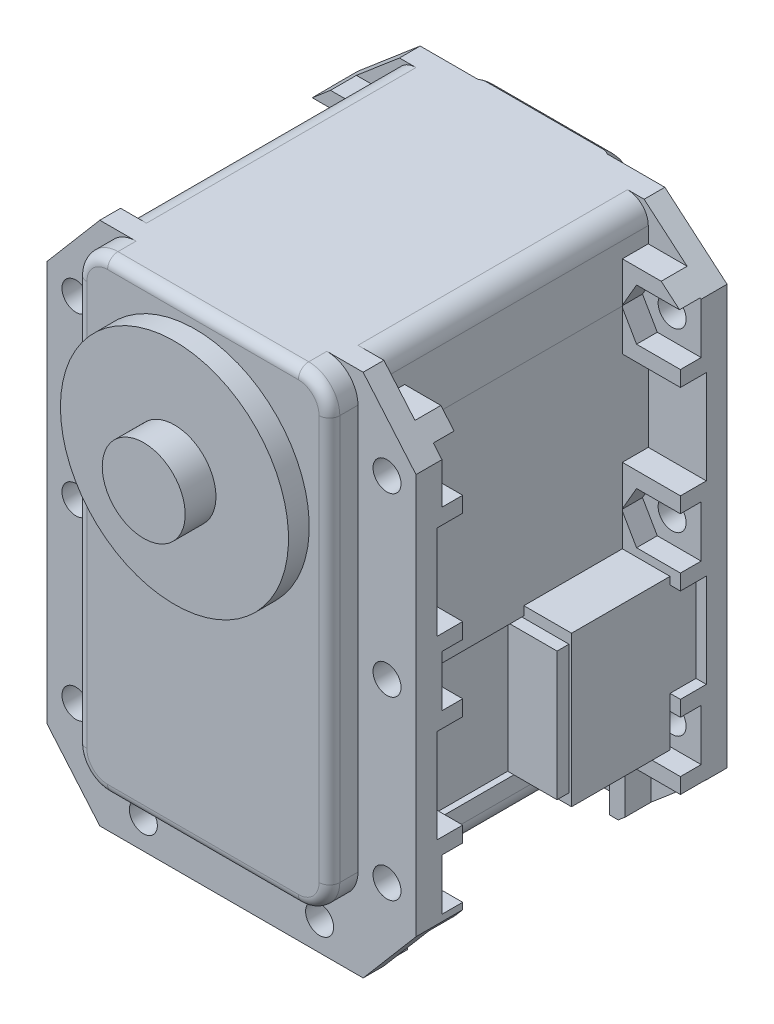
SolidWorks part; units mm, degrees
ref_plane "Front Plane" through (0, 0, 0) normal (0, 0, 1) x (1, 0, 0)
ref_plane "Top Plane" through (0, 0, 0) normal (0, 1, 0) x (1, 0, 0)
ref_plane "Right Plane" through (0, 0, 0) normal (1, 0, 0) x (0, 0, -1)
ref_plane "Plane1" through (7.15, 0, 0) normal (1, 0, 0) x (0, 0, -1)
sketch "Sketch1" plane through (7.15, 0, 0) normal (1, 0, 0) x (0, 0, -1)
  line L0 (15.2, 12) -> (15.2, 7)
  line L1 (15.2, 7) -> (17.75, 7)
  arc A0 (17.75, 7) -> (15.2, 12) centre (11.573, 7) ccw
extrude "Boss-Extrude1" add sketch "Sketch1" against normal blind 0.8723
sketch "Sketch2" plane through (6.2777, 0, 0) normal (-1, 0, 0) x (0, 0, 1)
  line L0 (-15.2, 7) -> (-17.75, 7)
  line L1 (-15.2, 12) -> (-15.2, 7)
  arc A0 (-17.75, 7) -> (-15.2, 12) centre (-11.573, 7) cw
extrude "Boss-Extrude2" add sketch "Sketch2" along normal blind 13.4277
ref_plane "Plane2" through (0, 7, 0) normal (0, -1, 0) x (1, 0, 0)
sketch "Sketch3" plane through (0, 7, 0) normal (0, -1, 0) x (1, 0, 0)
  line L0 (-17.8, -15.2) -> (-17.8, -17.75)
  line L1 (-17.8, -17.75) -> (-7.15, -17.75)
  line L2 (-7.15, -17.75) -> (-7.15, -15.2)
  line L3 (-7.15, -15.2) -> (-17.8, -15.2)
extrude "Boss-Extrude3" add sketch "Sketch3" against normal blind 5
sketch "Sketch4" plane through (0, 7, 0) normal (0, -1, 0) x (1, 0, 0)
  line L0 (7.15, -15.2) -> (7.15, -17.75)
  line L1 (7.15, -17.75) -> (17.8, -17.75)
  line L2 (17.8, -17.75) -> (17.8, -15.2)
  line L3 (17.8, -15.2) -> (7.15, -15.2)
extrude "Boss-Extrude4" add sketch "Sketch4" against normal blind 5
sketch "Sketch5" plane through (0, 7, 0) normal (0, -1, 0) x (1, 0, 0)
  line L0 (17.8, -15.2) -> (17.8, -17.75)
  line L1 (17.8, -17.75) -> (-17.8, -17.75)
  line L2 (-17.8, -17.75) -> (-17.8, -15.2)
  line L3 (-17.8, -15.2) -> (17.8, -15.2)
extrude "Boss-Extrude5" add sketch "Sketch5" along normal blind 40
sketch "Sketch6" plane through (0, 0, -15.2) normal (0, 0, 1) x (1, 0, 0)
  line L0 (17.8, -33) -> (-17.8, -33)
  line L1 (-17.8, -33) -> (-17.8, 12)
  line L2 (-17.8, 12) -> (17.8, 12)
  line L3 (17.8, 12) -> (17.8, -33)
extrude "Boss-Extrude6" add sketch "Sketch6" along normal blind 4.7
sketch "Sketch7" plane through (0, 0, -10.5) normal (0, 0, 1) x (1, 0, 0)
  line L0 (-8.5, -32.9421) -> (-8.6003, -33)
  line L1 (-8.6003, -33) -> (-17.8, -33)
  line L2 (-17.8, -33) -> (-17.8, 12)
  line L3 (-17.8, 12) -> (17.8, 12)
  line L4 (17.8, 12) -> (17.8, -33)
  line L5 (17.8, -33) -> (8.6003, -33)
  line L6 (8.6003, -33) -> (8.5, -32.9421)
  line L7 (8.5, -32.9421) -> (8.3997, -33)
  line L8 (8.3997, -33) -> (-8.3997, -33)
  line L9 (-8.3997, -33) -> (-8.5, -32.9421)
extrude "Boss-Extrude7" add sketch "Sketch7" along normal blind 21
sketch "Sketch8" plane through (0, 0, 10.5) normal (0, 0, 1) x (1, 0, 0)
  line L0 (-17.8, -33) -> (-17.8, 12)
  line L1 (-17.8, 12) -> (17.8, 12)
  line L2 (17.8, 12) -> (17.8, -33)
  line L3 (17.8, -33) -> (-17.8, -33)
extrude "Boss-Extrude8" add sketch "Sketch8" along normal blind 4.5
ref_plane "Plane3" through (0, 0, -1) normal (0, 0, -1) x (-1, 0, 0)
sketch "Sketch9" plane through (0, 0, -1) normal (0, 0, -1) x (-1, 0, 0)
  line L0 (12.2, -12.6003) -> (12.2, -33)
  line L1 (12.2, -33) -> (17.8, -33)
  line L2 (17.8, -33) -> (17.8, 12)
  line L3 (17.8, 12) -> (12.2, 12)
  line L4 (12.2, 12) -> (12.2, 4.6003)
  line L5 (12.2, 4.6003) -> (12.1421, 4.5)
  line L6 (12.1421, 4.5) -> (12.2, 4.3997)
  line L7 (12.2, 4.3997) -> (12.2, -12.3997)
  line L8 (12.2, -12.3997) -> (12.1421, -12.5)
  line L9 (12.1421, -12.5) -> (12.2, -12.6003)
extrude "Cut-Extrude1" cut sketch "Sketch9" against normal blind 11.5
sketch "Sketch10" plane through (0, 0, -17.75) normal (0, 0, -1) x (-1, 0, 0)
  line L0 (-16.8, -33) -> (-16.8, 12)
  line L1 (-16.8, 12) -> (-17.8, 12)
  line L2 (-17.8, 12) -> (-17.8, -33)
  line L3 (-17.8, -33) -> (-16.8, -33)
extrude "Cut-Extrude2" cut sketch "Sketch10" against normal blind 16.75
sketch "Sketch11" plane through (0, 0, -1) normal (0, 0, -1) x (-1, 0, 0)
  line L0 (-17.8, -33) -> (-12.2, -33)
  line L1 (-12.2, -33) -> (-12.2, -12.6003)
  line L2 (-12.2, -12.6003) -> (-12.1421, -12.5)
  line L3 (-12.1421, -12.5) -> (-12.2, -12.3997)
  line L4 (-12.2, -12.3997) -> (-12.2, 4.3997)
  line L5 (-12.2, 4.3997) -> (-12.1421, 4.5)
  line L6 (-12.1421, 4.5) -> (-12.2, 4.6003)
  line L7 (-12.2, 4.6003) -> (-12.2, 12)
  line L8 (-12.2, 12) -> (-17.8, 12)
  line L9 (-17.8, 12) -> (-17.8, -33)
extrude "Cut-Extrude3" cut sketch "Sketch11" against normal blind 11.5
sketch "Sketch12" plane through (0, -33, 0) normal (0, -1, 0) x (1, 0, 0)
  line L0 (12.2, -1) -> (12.2, -10.5)
  line L1 (12.2, -10.5) -> (16.8, -10.5)
  line L2 (16.8, -10.5) -> (16.8, -1)
  line L3 (16.8, -1) -> (12.2, -1)
extrude "Cut-Extrude4" cut sketch "Sketch12" against normal blind 2.75
sketch "Sketch13" plane through (0, 0, -1) normal (0, 0, 1) x (1, 0, 0)
  line L0 (-12.2, -33) -> (-12.2, -30.25)
  line L1 (-12.2, -30.25) -> (-16.8, -30.25)
  line L2 (-16.8, -30.25) -> (-16.8, -27.025)
  line L3 (-16.8, -27.025) -> (-17.8, -27.025)
  line L4 (-17.8, -27.025) -> (-17.8, -33)
  line L5 (-17.8, -33) -> (-12.2, -33)
extrude "Cut-Extrude5" cut sketch "Sketch13" against normal blind 9.5
sketch "Sketch14" plane through (0, 0, -10.5) normal (0, 0, 1) x (1, 0, 0)
  line L0 (-17.8, -27.025) -> (-17.8, -31.975)
  line L1 (-17.8, -31.975) -> (-13.5711, -31.975)
  line L2 (-13.5711, -31.975) -> (-12.1421, -29.5)
  line L3 (-12.1421, -29.5) -> (-13.5711, -27.025)
  line L4 (-13.5711, -27.025) -> (-17.8, -27.025)
extrude "Cut-Extrude6" cut sketch "Sketch14" against normal blind 2
sketch "Sketch15" plane through (0, 0, -10.5) normal (0, 0, 1) x (1, 0, 0)
  line L0 (13.5711, -31.975) -> (16.8, -31.975)
  line L1 (16.8, -31.975) -> (16.8, -27.025)
  line L2 (16.8, -27.025) -> (13.5711, -27.025)
  line L3 (13.5711, -27.025) -> (12.1421, -29.5)
  line L4 (12.1421, -29.5) -> (13.5711, -31.975)
extrude "Cut-Extrude7" cut sketch "Sketch15" against normal blind 2
sketch "Sketch16" plane through (0, 0, 10.5) normal (0, 0, -1) x (-1, 0, 0)
  line L0 (12.1421, -29.5) -> (13.5711, -31.975)
  line L1 (13.5711, -31.975) -> (17.8, -31.975)
  line L2 (17.8, -31.975) -> (17.8, -27.025)
  line L3 (17.8, -27.025) -> (13.5711, -27.025)
  line L4 (13.5711, -27.025) -> (12.1421, -29.5)
extrude "Cut-Extrude8" cut sketch "Sketch16" against normal blind 2
sketch "Sketch17" plane through (0, 0, 10.5) normal (0, 0, -1) x (-1, 0, 0)
  line L0 (-12.1421, -29.5) -> (-13.5711, -27.025)
  line L1 (-13.5711, -27.025) -> (-17.8, -27.025)
  line L2 (-17.8, -27.025) -> (-17.8, -31.975)
  line L3 (-17.8, -31.975) -> (-13.5711, -31.975)
  line L4 (-13.5711, -31.975) -> (-12.1421, -29.5)
extrude "Cut-Extrude9" cut sketch "Sketch17" against normal blind 2
sketch "Sketch18" plane through (0, 0, -1) normal (0, 0, 1) x (1, 0, 0)
  line L0 (-12.1421, 4.5) -> (-12.2, 4.6003)
  line L1 (-12.2, 4.6003) -> (-12.2, 12)
  line L2 (-12.2, 12) -> (-17.8, 12)
  line L3 (-17.8, 12) -> (-17.8, -27.025)
  line L4 (-17.8, -27.025) -> (-16.8, -27.025)
  line L5 (-16.8, -27.025) -> (-16.8, -14.975)
  line L6 (-16.8, -14.975) -> (-13.5711, -14.975)
  line L7 (-13.5711, -14.975) -> (-12.1421, -12.5)
  line L8 (-12.1421, -12.5) -> (-12.2, -12.3997)
  line L9 (-12.2, -12.3997) -> (-12.2, 4.3997)
  line L10 (-12.2, 4.3997) -> (-12.1421, 4.5)
extrude "Cut-Extrude10" cut sketch "Sketch18" against normal blind 9.5
sketch "Sketch19" plane through (0, 0, -1) normal (0, 0, 1) x (1, 0, 0)
  line L0 (16.8, -14.975) -> (16.8, 12)
  line L1 (16.8, 12) -> (12.2, 12)
  line L2 (12.2, 12) -> (12.2, 4.6003)
  line L3 (12.2, 4.6003) -> (12.1421, 4.5)
  line L4 (12.1421, 4.5) -> (12.2, 4.3997)
  line L5 (12.2, 4.3997) -> (12.2, -12.3997)
  line L6 (12.2, -12.3997) -> (12.1421, -12.5)
  line L7 (12.1421, -12.5) -> (13.5711, -14.975)
  line L8 (13.5711, -14.975) -> (16.8, -14.975)
extrude "Cut-Extrude11" cut sketch "Sketch19" against normal blind 9.5
sketch "Sketch20" plane through (0, -33, 0) normal (0, -1, 0) x (1, 0, 0)
  line L0 (-17.8, -17.75) -> (-17.8, -10.5)
  line L1 (-17.8, -10.5) -> (16.8, -10.5)
  line L2 (16.8, -10.5) -> (16.8, -17.75)
  line L3 (16.8, -17.75) -> (-17.8, -17.75)
extrude "Boss-Extrude9" add sketch "Sketch20" along normal blind 5.6
sketch "Sketch21" plane through (0, 0, -17.75) normal (0, 0, -1) x (-1, 0, 0)
  line L0 (-7.15, 12) -> (-16.8, 12)
  line L1 (-16.8, 12) -> (-16.8, -38.6)
  line L2 (-16.8, -38.6) -> (17.8, -38.6)
  line L3 (17.8, -38.6) -> (17.8, 12)
  line L4 (17.8, 12) -> (7.15, 12)
  line L5 (7.15, 12) -> (7.15, 7)
  line L6 (7.15, 7) -> (12.2, 7)
  line L7 (12.2, 7) -> (12.2, -28)
  line L8 (12.2, -28) -> (-12.2, -28)
  line L9 (-12.2, -28) -> (-12.2, 7)
  line L10 (-12.2, 7) -> (-7.15, 7)
  line L11 (-7.15, 7) -> (-7.15, 12)
extrude "Cut-Extrude12" cut sketch "Sketch21" against normal blind 2.55
sketch "Sketch22" plane through (0, 0, -15.2) normal (0, 0, -1) x (-1, 0, 0)
  line L0 (-7.15, 12) -> (-16.8, 12)
  line L1 (-16.8, 12) -> (-16.8, -38.6)
  line L2 (-16.8, -38.6) -> (17.8, -38.6)
  line L3 (17.8, -38.6) -> (17.8, 12)
  line L4 (17.8, 12) -> (7.15, 12)
  line L5 (7.15, 12) -> (7.15, 7)
  line L6 (7.15, 7) -> (12.2, 7)
  line L7 (12.2, 7) -> (12.2, -28)
  line L8 (12.2, -28) -> (-12.2, -28)
  line L9 (-12.2, -28) -> (-12.2, 7)
  line L10 (-12.2, 7) -> (-7.15, 7)
  line L11 (-7.15, 7) -> (-7.15, 12)
extrude "Cut-Extrude13" cut sketch "Sketch22" against normal blind 0.2
sketch "Sketch23" plane through (16.8, 0, 0) normal (1, 0, 0) x (0, 0, -1)
  line L0 (10.5, 12) -> (15, 12)
  line L1 (15, 12) -> (15, -38.6)
  line L2 (15, -38.6) -> (10.5, -38.6)
  line L3 (10.5, -38.6) -> (10.5, -31.975)
  line L4 (10.5, -31.975) -> (12.5, -31.975)
  line L5 (12.5, -31.975) -> (12.5, -27.025)
  line L6 (12.5, -27.025) -> (10.5, -27.025)
  line L7 (10.5, -27.025) -> (10.5, 12)
extrude "Boss-Extrude10" add sketch "Sketch23" along normal blind 1
sketch "Sketch24" plane through (0, -33, 0) normal (0, -1, 0) x (1, 0, 0)
  line L0 (-17.8, 10.5) -> (-17.8, 15)
  line L1 (-17.8, 15) -> (17.8, 15)
  line L2 (17.8, 15) -> (17.8, 10.5)
  line L3 (17.8, 10.5) -> (-17.8, 10.5)
extrude "Boss-Extrude11" add sketch "Sketch24" along normal blind 5.6
sketch "Sketch25" plane through (-12.2, 0, 0) normal (-1, 0, 0) x (0, 0, 1)
  line L0 (-1, -29.4) -> (10.5, -29.4)
  line L1 (10.5, -29.4) -> (10.5, -16.6)
  line L2 (10.5, -16.6) -> (-1, -16.6)
  line L3 (-1, -16.6) -> (-1, -29.4)
extrude "Cut-Extrude14" cut sketch "Sketch25" against normal blind 0.6
sketch "Sketch26" plane through (12.2, 0, 0) normal (1, 0, 0) x (0, 0, -1)
  line L0 (1, -16.6) -> (-10.5, -16.6)
  line L1 (-10.5, -16.6) -> (-10.5, -29.4)
  line L2 (-10.5, -29.4) -> (1, -29.4)
  line L3 (1, -29.4) -> (1, -16.6)
extrude "Cut-Extrude15" cut sketch "Sketch26" against normal blind 0.6
sketch "Sketch27" plane through (0, 0, -10.5) normal (0, 0, 1) x (1, 0, 0)
  line L0 (-17.8, 6.975) -> (-17.8, 2.025)
  line L1 (-17.8, 2.025) -> (-13.5711, 2.025)
  line L2 (-13.5711, 2.025) -> (-12.1421, 4.5)
  line L3 (-12.1421, 4.5) -> (-13.5711, 6.975)
  line L4 (-13.5711, 6.975) -> (-17.8, 6.975)
extrude "Cut-Extrude16" cut sketch "Sketch27" against normal blind 2
sketch "Sketch28" plane through (0, 0, -10.5) normal (0, 0, 1) x (1, 0, 0)
  line L0 (-17.8, -14.975) -> (-13.5711, -14.975)
  line L1 (-13.5711, -14.975) -> (-12.1421, -12.5)
  line L2 (-12.1421, -12.5) -> (-13.5711, -10.025)
  line L3 (-13.5711, -10.025) -> (-17.8, -10.025)
  line L4 (-17.8, -10.025) -> (-17.8, -14.975)
extrude "Cut-Extrude17" cut sketch "Sketch28" against normal blind 2
sketch "Sketch29" plane through (0, 0, -10.5) normal (0, 0, 1) x (1, 0, 0)
  line L0 (-6.025, -38.6) -> (-6.025, -34.3711)
  line L1 (-6.025, -34.3711) -> (-8.5, -32.9421)
  line L2 (-8.5, -32.9421) -> (-10.975, -34.3711)
  line L3 (-10.975, -34.3711) -> (-10.975, -38.6)
  line L4 (-10.975, -38.6) -> (-6.025, -38.6)
extrude "Cut-Extrude18" cut sketch "Sketch29" against normal blind 2
sketch "Sketch30" plane through (0, 0, -10.5) normal (0, 0, 1) x (1, 0, 0)
  line L0 (17.8, 2.025) -> (17.8, 6.975)
  line L1 (17.8, 6.975) -> (13.5711, 6.975)
  line L2 (13.5711, 6.975) -> (12.1421, 4.5)
  line L3 (12.1421, 4.5) -> (13.5711, 2.025)
  line L4 (13.5711, 2.025) -> (17.8, 2.025)
extrude "Cut-Extrude19" cut sketch "Sketch30" against normal blind 2
sketch "Sketch31" plane through (0, 0, -10.5) normal (0, 0, 1) x (1, 0, 0)
  line L0 (17.8, -10.025) -> (13.5711, -10.025)
  line L1 (13.5711, -10.025) -> (12.1421, -12.5)
  line L2 (12.1421, -12.5) -> (13.5711, -14.975)
  line L3 (13.5711, -14.975) -> (17.8, -14.975)
  line L4 (17.8, -14.975) -> (17.8, -10.025)
extrude "Cut-Extrude20" cut sketch "Sketch31" against normal blind 2
sketch "Sketch32" plane through (0, 0, -10.5) normal (0, 0, 1) x (1, 0, 0)
  line L0 (10.975, -38.6) -> (10.975, -34.3711)
  line L1 (10.975, -34.3711) -> (8.5, -32.9421)
  line L2 (8.5, -32.9421) -> (6.025, -34.3711)
  line L3 (6.025, -34.3711) -> (6.025, -38.6)
  line L4 (6.025, -38.6) -> (10.975, -38.6)
extrude "Cut-Extrude21" cut sketch "Sketch32" against normal blind 2
sketch "Sketch33" plane through (0, 0, 10.5) normal (0, 0, -1) x (-1, 0, 0)
  line L0 (13.5711, 2.025) -> (17.8, 2.025)
  line L1 (17.8, 2.025) -> (17.8, 6.975)
  line L2 (17.8, 6.975) -> (13.5711, 6.975)
  line L3 (13.5711, 6.975) -> (12.1421, 4.5)
  line L4 (12.1421, 4.5) -> (13.5711, 2.025)
extrude "Cut-Extrude22" cut sketch "Sketch33" against normal blind 2
sketch "Sketch34" plane through (0, 0, 10.5) normal (0, 0, -1) x (-1, 0, 0)
  line L0 (12.1421, -12.5) -> (13.5711, -14.975)
  line L1 (13.5711, -14.975) -> (17.8, -14.975)
  line L2 (17.8, -14.975) -> (17.8, -10.025)
  line L3 (17.8, -10.025) -> (13.5711, -10.025)
  line L4 (13.5711, -10.025) -> (12.1421, -12.5)
extrude "Cut-Extrude23" cut sketch "Sketch34" against normal blind 2
sketch "Sketch35" plane through (0, 0, 10.5) normal (0, 0, -1) x (-1, 0, 0)
  line L0 (8.5, -32.9421) -> (6.025, -34.3711)
  line L1 (6.025, -34.3711) -> (6.025, -38.6)
  line L2 (6.025, -38.6) -> (10.975, -38.6)
  line L3 (10.975, -38.6) -> (10.975, -34.3711)
  line L4 (10.975, -34.3711) -> (8.5, -32.9421)
extrude "Cut-Extrude24" cut sketch "Sketch35" against normal blind 2
sketch "Sketch36" plane through (0, 0, 10.5) normal (0, 0, -1) x (-1, 0, 0)
  line L0 (-12.1421, 4.5) -> (-13.5711, 6.975)
  line L1 (-13.5711, 6.975) -> (-17.8, 6.975)
  line L2 (-17.8, 6.975) -> (-17.8, 2.025)
  line L3 (-17.8, 2.025) -> (-13.5711, 2.025)
  line L4 (-13.5711, 2.025) -> (-12.1421, 4.5)
extrude "Cut-Extrude25" cut sketch "Sketch36" against normal blind 2
sketch "Sketch37" plane through (0, 0, 10.5) normal (0, 0, -1) x (-1, 0, 0)
  line L0 (-12.1421, -12.5) -> (-13.5711, -10.025)
  line L1 (-13.5711, -10.025) -> (-17.8, -10.025)
  line L2 (-17.8, -10.025) -> (-17.8, -14.975)
  line L3 (-17.8, -14.975) -> (-13.5711, -14.975)
  line L4 (-13.5711, -14.975) -> (-12.1421, -12.5)
extrude "Cut-Extrude26" cut sketch "Sketch37" against normal blind 2
sketch "Sketch38" plane through (0, 0, 10.5) normal (0, 0, -1) x (-1, 0, 0)
  line L0 (-8.5, -32.9421) -> (-10.975, -34.3711)
  line L1 (-10.975, -34.3711) -> (-10.975, -38.6)
  line L2 (-10.975, -38.6) -> (-6.025, -38.6)
  line L3 (-6.025, -38.6) -> (-6.025, -34.3711)
  line L4 (-6.025, -34.3711) -> (-8.5, -32.9421)
extrude "Cut-Extrude27" cut sketch "Sketch38" against normal blind 2
ref_plane "Plane4" through (0, 0, -10.5) normal (0, 0, -1) x (-1, 0, 0)
sketch "Sketch39" plane through (0, 0, -10.5) normal (0, 0, -1) x (-1, 0, 0)
  line L0 (12.2, -14.975) -> (13.5711, -14.975)
  line L1 (13.5711, -14.975) -> (12.2, -12.6003)
  line L2 (12.2, -12.6003) -> (12.2, -14.975)
extrude "Cut-Extrude28" cut sketch "Sketch39" against normal up to next
sketch "Sketch40" plane through (0, -14.975, 0) normal (0, 1, 0) x (-1, 0, 0)
  line L0 (16.8, -10.5) -> (16.8, -1)
  line L1 (16.8, -1) -> (12.2, -1)
  line L2 (12.2, -1) -> (12.2, -10.5)
  line L3 (12.2, -10.5) -> (16.8, -10.5)
extrude "Cut-Extrude29" cut sketch "Sketch40" against normal blind 0.775
sketch "Sketch41" plane through (0, 0, -10.5) normal (0, 0, -1) x (-1, 0, 0)
  line L0 (-13.5711, -14.975) -> (-12.2, -14.975)
  line L1 (-12.2, -14.975) -> (-12.2, -12.6003)
  line L2 (-12.2, -12.6003) -> (-13.5711, -14.975)
extrude "Cut-Extrude30" cut sketch "Sketch41" against normal up to next
sketch "Sketch42" plane through (0, -14.975, 0) normal (0, 1, 0) x (-1, 0, 0)
  line L0 (-16.8, -1) -> (-16.8, -10.5)
  line L1 (-16.8, -10.5) -> (-12.2, -10.5)
  line L2 (-12.2, -10.5) -> (-12.2, -1)
  line L3 (-12.2, -1) -> (-16.8, -1)
extrude "Cut-Extrude31" cut sketch "Sketch42" against normal blind 0.775
sketch "Sketch43" plane through (0, -38.6, 0) normal (0, -1, 0) x (1, 0, 0)
  line L0 (-4.525, 13) -> (-4.525, 10.5)
  line L1 (-4.525, 10.5) -> (4.525, 10.5)
  line L2 (4.525, 10.5) -> (4.525, 13)
  line L3 (4.525, 13) -> (-4.525, 13)
extrude "Cut-Extrude32" cut sketch "Sketch43" against normal blind 5.6
sketch "Sketch44" plane through (0, 0, 10.5) normal (0, 0, -1) x (-1, 0, 0)
  line L0 (-17.8, -16.475) -> (-17.8, -25.525)
  line L1 (-17.8, -25.525) -> (-12.2, -25.525)
  line L2 (-12.2, -25.525) -> (-12.2, -16.475)
  line L3 (-12.2, -16.475) -> (-17.8, -16.475)
extrude "Cut-Extrude33" cut sketch "Sketch44" against normal blind 2.5
sketch "Sketch45" plane through (0, -38.6, 0) normal (0, -1, 0) x (1, 0, 0)
  line L0 (-4.525, -10.5) -> (-4.525, -13)
  line L1 (-4.525, -13) -> (4.525, -13)
  line L2 (4.525, -13) -> (4.525, -10.5)
  line L3 (4.525, -10.5) -> (-4.525, -10.5)
extrude "Cut-Extrude34" cut sketch "Sketch45" against normal blind 5.6
sketch "Sketch46" plane through (-17.8, 0, 0) normal (-1, 0, 0) x (0, 0, 1)
  line L0 (-10.5, 0.525) -> (-13, 0.525)
  line L1 (-13, 0.525) -> (-13, -8.525)
  line L2 (-13, -8.525) -> (-10.5, -8.525)
  line L3 (-10.5, -8.525) -> (-10.5, 0.525)
extrude "Cut-Extrude35" cut sketch "Sketch46" against normal blind 5.6
sketch "Sketch47" plane through (17.8, 0, 0) normal (1, 0, 0) x (0, 0, -1)
  line L0 (10.5, -25.525) -> (13, -25.525)
  line L1 (13, -25.525) -> (13, -16.475)
  line L2 (13, -16.475) -> (10.5, -16.475)
  line L3 (10.5, -16.475) -> (10.5, -25.525)
extrude "Cut-Extrude36" cut sketch "Sketch47" against normal blind 1
sketch "Sketch48" plane through (-17.8, 0, 0) normal (-1, 0, 0) x (0, 0, 1)
  line L0 (13, -16.475) -> (10.5, -16.475)
  line L1 (10.5, -16.475) -> (10.5, -25.525)
  line L2 (10.5, -25.525) -> (13, -25.525)
  line L3 (13, -25.525) -> (13, -16.475)
extrude "Cut-Extrude37" cut sketch "Sketch48" against normal blind 5.6
sketch "Sketch49" plane through (-17.8, 0, 0) normal (-1, 0, 0) x (0, 0, 1)
  line L0 (-10.5, -16.475) -> (-13, -16.475)
  line L1 (-13, -16.475) -> (-13, -25.525)
  line L2 (-13, -25.525) -> (-10.5, -25.525)
  line L3 (-10.5, -25.525) -> (-10.5, -16.475)
extrude "Cut-Extrude38" cut sketch "Sketch49" against normal blind 1
sketch "Sketch50" plane through (17.8, 0, 0) normal (1, 0, 0) x (0, 0, -1)
  line L0 (-13, 8.475) -> (-10.5, 8.475)
  line L1 (-10.5, 8.475) -> (-10.5, 12)
  line L2 (-10.5, 12) -> (-13, 12)
  line L3 (-13, 12) -> (-13, 8.475)
extrude "Cut-Extrude39" cut sketch "Sketch50" against normal blind 5.6
sketch "Sketch51" plane through (-17.8, 0, 0) normal (-1, 0, 0) x (0, 0, 1)
  line L0 (13, 0.525) -> (10.5, 0.525)
  line L1 (10.5, 0.525) -> (10.5, -8.525)
  line L2 (10.5, -8.525) -> (13, -8.525)
  line L3 (13, -8.525) -> (13, 0.525)
extrude "Cut-Extrude40" cut sketch "Sketch51" against normal blind 5.6
sketch "Sketch52" plane through (17.8, 0, 0) normal (1, 0, 0) x (0, 0, -1)
  line L0 (10.5, -8.525) -> (13, -8.525)
  line L1 (13, -8.525) -> (13, 0.525)
  line L2 (13, 0.525) -> (10.5, 0.525)
  line L3 (10.5, 0.525) -> (10.5, -8.525)
extrude "Cut-Extrude41" cut sketch "Sketch52" against normal blind 5.6
sketch "Sketch53" plane through (17.8, 0, 0) normal (1, 0, 0) x (0, 0, -1)
  line L0 (-13, -8.525) -> (-10.5, -8.525)
  line L1 (-10.5, -8.525) -> (-10.5, 0.525)
  line L2 (-10.5, 0.525) -> (-13, 0.525)
  line L3 (-13, 0.525) -> (-13, -8.525)
extrude "Cut-Extrude42" cut sketch "Sketch53" against normal blind 5.6
sketch "Sketch54" plane through (17.8, 0, 0) normal (1, 0, 0) x (0, 0, -1)
  line L0 (10.5, 8.475) -> (13, 8.475)
  line L1 (13, 8.475) -> (13, 12)
  line L2 (13, 12) -> (10.5, 12)
  line L3 (10.5, 12) -> (10.5, 8.475)
extrude "Cut-Extrude43" cut sketch "Sketch54" against normal blind 5.6
sketch "Sketch55" plane through (-17.8, 0, 0) normal (-1, 0, 0) x (0, 0, 1)
  line L0 (10.5, 8.475) -> (13, 8.475)
  line L1 (13, 8.475) -> (13, 12)
  line L2 (13, 12) -> (10.5, 12)
  line L3 (10.5, 12) -> (10.5, 8.475)
extrude "Cut-Extrude44" cut sketch "Sketch55" against normal blind 5.6
sketch "Sketch56" plane through (-17.8, 0, 0) normal (-1, 0, 0) x (0, 0, 1)
  line L0 (-13, 8.475) -> (-10.5, 8.475)
  line L1 (-10.5, 8.475) -> (-10.5, 12)
  line L2 (-10.5, 12) -> (-13, 12)
  line L3 (-13, 12) -> (-13, 8.475)
extrude "Cut-Extrude45" cut sketch "Sketch56" against normal blind 5.6
sketch "Sketch57" plane through (0, 0, -15) normal (0, 0, -1) x (-1, 0, 0)
  line L0 (-7.15, -33) -> (-7.15, -28)
  line L1 (-7.15, -28) -> (7.15, -28)
  line L2 (7.15, -28) -> (7.15, -33)
  line L3 (7.15, -33) -> (-7.15, -33)
extrude "Boss-Extrude12" add sketch "Sketch57" along normal blind 2.75
sketch "Sketch58" plane through (-17.8, 0, 0) normal (-1, 0, 0) x (0, 0, 1)
  line L0 (-10.5, -33.475) -> (-13, -33.475)
  line L1 (-13, -33.475) -> (-13, -38.6)
  line L2 (-13, -38.6) -> (-10.5, -38.6)
  line L3 (-10.5, -38.6) -> (-10.5, -33.475)
extrude "Cut-Extrude46" cut sketch "Sketch58" against normal blind 5.325
sketch "Sketch59" plane through (0, 0, -10.5) normal (0, 0, 1) x (1, 0, 0)
  line L0 (17.8, -33.475) -> (12.475, -33.475)
  line L1 (12.475, -33.475) -> (12.475, -38.6)
  line L2 (12.475, -38.6) -> (17.8, -38.6)
  line L3 (17.8, -38.6) -> (17.8, -33.475)
extrude "Cut-Extrude47" cut sketch "Sketch59" against normal blind 2.5
sketch "Sketch60" plane through (-17.8, 0, 0) normal (-1, 0, 0) x (0, 0, 1)
  line L0 (10.5, -38.6) -> (13, -38.6)
  line L1 (13, -38.6) -> (13, -33.475)
  line L2 (13, -33.475) -> (10.5, -33.475)
  line L3 (10.5, -33.475) -> (10.5, -38.6)
extrude "Cut-Extrude48" cut sketch "Sketch60" against normal blind 5.325
sketch "Sketch61" plane through (0, -38.6, 0) normal (0, -1, 0) x (1, 0, 0)
  line L0 (12.475, 13) -> (12.475, 10.5)
  line L1 (12.475, 10.5) -> (17.8, 10.5)
  line L2 (17.8, 10.5) -> (17.8, 13)
  line L3 (17.8, 13) -> (12.475, 13)
extrude "Cut-Extrude49" cut sketch "Sketch61" against normal blind 5.125
sketch "Sketch62" plane through (0, 0, 15) normal (0, 0, 1) x (1, 0, 0)
  line L0 (-12.2, -33) -> (-12.2, 12)
  line L1 (-12.2, 12) -> (12.2, 12)
  line L2 (12.2, 12) -> (12.2, -33)
  line L3 (12.2, -33) -> (-12.2, -33)
extrude "Boss-Extrude13" add sketch "Sketch62" along normal blind 2.75
sketch "Sketch63" plane through (0, 0, -1) normal (0, 0, 1) x (1, 0, 0)
  line L0 (-16.55, -29.21) -> (-16.55, -16.79)
  line L1 (-16.55, -16.79) -> (-11.83, -16.79)
  line L2 (-11.83, -16.79) -> (-11.83, -29.21)
  line L3 (-11.83, -29.21) -> (-16.55, -29.21)
extrude "Boss-Extrude14" add sketch "Sketch63" along normal blind 1.15
sketch "Sketch64" plane through (0, 0, -1) normal (0, 0, 1) x (1, 0, 0)
  line L0 (16.55, -29.21) -> (11.83, -29.21)
  line L1 (11.83, -29.21) -> (11.83, -16.79)
  line L2 (11.83, -16.79) -> (16.55, -16.79)
  line L3 (16.55, -16.79) -> (16.55, -29.21)
extrude "Boss-Extrude15" add sketch "Sketch64" along normal blind 1.15
hole_wizard "Ø13.0 (13) Diameter Hole1" positions "Sketch66" profile "Sketch65" hole size "Ø13.0" standard "ANSI Metric"
sketch "Sketch66" plane through (0, 0, -17.75) normal (0, 0, -1) x (-1, 0, 0)
  point P0 (0, 0)
sketch "Sketch65" plane through (0, 0, -17.75) normal (1, 0, 0) x (0, 1, 0)
  line L0 (0, 0) -> (0, 1)
  line L1 (0, 1) -> (6.5, 1)
  line L2 (6.5, 1) -> (6.5, 0)
  line L5 (6.5, 0) -> (0, 0)
  line L10 (0, 1) -> (-6.5, 1) construction
  line L11 (0, -6.35) -> (0, 107.95) construction
  dimension "Hole Dia." = 13
  dimension "Hole Depth" = 1
  dimension "Drill Angle" = 180
ref_plane "Plane5" through (0, 0, 0) normal (0, -1, 0) x (1, 0, 0)
sketch "Sketch67" plane through (0, 0, 0) normal (0, -1, 0) x (1, 0, 0)
  line L1 (0, 23.4656) -> (0, 17.75)
  line L2 (0, 17.75) -> (5, 17.75)
  line L3 (5, 17.75) -> (5, 18.5)
  line L4 (5, 18.5) -> (11, 18.5)
  line L5 (11, 18.5) -> (11, 20.5)
  line L6 (11, 20.5) -> (4, 20.5)
  line L7 (4, 20.5) -> (4, 23.4656)
  line L8 (4, 23.4656) -> (0, 23.4656)
  line L10 (0, 25.85) -> (0, 17.75) construction
  dimension "D1" = 11
  dimension "D2" = 2
  dimension "D3" = 2.9656
  dimension "D4" = 4
revolve "Revolve1" add sketch "Sketch67" angle 360 about L10
hole_wizard "Ø2.7 (2.7) Diameter Hole1" positions "Sketch70" profile "Sketch69" hole size "Ø2.7" standard "ANSI Metric"
sketch "Sketch70" plane through (0, 0, 12.5) normal (0, 0, -1) x (-1, 0, 0)
  point P0 (15, 4.5)
  point P1 (15, -12.5)
  point P2 (8.5, -35.8)
  point P3 (-15, 4.5)
  point P4 (-15, -12.5)
  point P5 (-8.5, -35.8)
  point P6 (15, -29.5)
  point P7 (-15, -29.5)
sketch "Sketch69" plane through (-15, 4.5, 12.5) normal (1, 0, 0) x (0, 1, 0)
  line L0 (0, 0) -> (0, 10.9656)
  line L1 (0, 10.9656) -> (1.35, 10.9656)
  line L2 (1.35, 10.9656) -> (1.35, 0)
  line L5 (1.35, 0) -> (0, 0)
  line L11 (0, -6.35) -> (0, 107.95) construction
  dimension "Thru Hole Dia." = 2.7
  dimension "Thru Hole Depth" = 10.9656
hole_wizard "Ø2.7 (2.7) Diameter Hole2" positions "Sketch72" profile "Sketch71" hole size "Ø2.7" standard "ANSI Metric"
sketch "Sketch72" plane through (0, 0, -12.5) normal (0, 0, 1) x (1, 0, 0)
  point P0 (-15, 4.5)
  point P1 (-15, -12.5)
  point P2 (-8.5, -35.8)
  point P3 (15, 4.5)
  point P4 (15, -12.5)
  point P5 (8.5, -35.8)
  point P6 (-15, -29.5)
  point P7 (15, -29.5)
sketch "Sketch71" plane through (-15, 4.5, -12.5) normal (1, 0, 0) x (0, -1, 0)
  line L0 (0, 0) -> (0, 5.3)
  line L1 (0, 5.3) -> (1.35, 5.3)
  line L2 (1.35, 5.3) -> (1.35, 0)
  line L5 (1.35, 0) -> (0, 0)
  line L11 (0, -6.35) -> (0, 107.95) construction
  dimension "Thru Hole Dia." = 2.7
  dimension "Thru Hole Depth" = 5.3
sketch "Sketch73" plane through (0, 0, 0) normal (0, 0, 1) x (1, 0, 0)
  line L0 (12.1421, -12.5) -> (12.2, -12.6003)
  line L1 (12.2, -12.6003) -> (12.2, -12.3997)
rib "Rib1" sketch "Sketch73" sketch "Sketch73" thickness 21 extrusion direction parallel to sketch draft on no parameters "D1"=21
sketch "Sketch74" plane through (0, 0, 0) normal (0, 0, 1) x (1, 0, 0)
  line L0 (12.2, 4.3997) -> (12.2, 4.6003)
  line L1 (12.2, 4.6003) -> (12.1421, 4.5)
rib "Rib2" sketch "Sketch74" sketch "Sketch74" thickness 21 extrusion direction parallel to sketch draft on no parameters "D1"=21
ref_plane "Plane6" through (0, 0, 0) normal (0, 0, -1) x (-1, 0, 0)
sketch "Sketch75" plane through (0, 0, 0) normal (0, 0, -1) x (-1, 0, 0)
  line L0 (12.1421, -12.5) -> (12.2, -12.6003)
  line L1 (12.2, -12.6003) -> (12.2, -12.3997)
rib "Rib3" sketch "Sketch75" sketch "Sketch75" thickness 21 extrusion direction parallel to sketch draft on no parameters "D1"=21
sketch "Sketch76" plane through (0, 0, 0) normal (0, 0, -1) x (-1, 0, 0)
  line L0 (12.1421, 4.5) -> (12.2, 4.3997)
  line L1 (12.2, 4.3997) -> (12.2, 4.6003)
rib "Rib4" sketch "Sketch76" sketch "Sketch76" thickness 21 extrusion direction parallel to sketch draft on no parameters "D1"=21
sketch "Sketch77" plane through (0, 0, 0) normal (0, 0, -1) x (-1, 0, 0)
  line L0 (-8.5, -32.9421) -> (-8.6003, -33)
  line L1 (-8.6003, -33) -> (-8.3997, -33)
rib "Rib5" sketch "Sketch77" sketch "Sketch77" thickness 21 extrusion direction parallel to sketch draft on no parameters "D1"=21
sketch "Sketch78" plane through (0, 0, 0) normal (0, 0, 1) x (1, 0, 0)
  line L0 (-8.5, -32.9421) -> (-8.6003, -33)
  line L1 (-8.6003, -33) -> (-8.3997, -33)
rib "Rib6" sketch "Sketch78" sketch "Sketch78" thickness 21 extrusion direction parallel to sketch draft on no parameters "D1"=21
fillet "Fillet1" radius 2 8 edges at (12.2, 12, 0) (-12.2, 12, 0) (-7.15, -28, -16.375) (7.15, -28, -16.375)
fillet "Fillet2" radius 1.5 15 edges at (-7.9017, 7.4374, -17.7345) (-12.2, -10.5, -17.75) (-10.675, -28, -17.75) (-7.7358, -28.5858, -17.75) (-7.15, -31.5, -17.75) (0, -33, -17.75) (7.15, -31.5, -17.75) (7.7358, -28.5858, -17.75) (10.675, -28, -17.75) (12.2, -10.5, -17.75) (7.565, 7.7803, -17.7005)
fillet "Fillet3" radius 3 4 edges at (12.2, -33, 16.375) (-12.2, -33, 16.375)
chamfer "Chamfer1" distance 6 angle 40.365 2 edges at (17.8, 12, 14) (-17.8, 12, 14)
chamfer "Chamfer2" distance 5.1 angle 49.635 4 edges at (17.8, -38.6, -14) (-17.8, -38.6, -14) (-17.8, -33.475, 11.75) (-17.8, -38.6, 14)
chamfer "Chamfer3" distance 6 angle 40.365 2 edges at (17.8, 12, -14) (17.8, -38.6, 14)
fillet "Fillet4" radius 1 20 edges at (12.2, -10.5, 17.75) (11.3213, 11.1213, 17.75) (11.3213, -32.1213, 17.75) (0, 12, 17.75) (0, -33, 17.75) (-11.3213, 11.1213, 17.75) (-11.3213, -32.1213, 17.75) (-12.2, -10.5, 17.75) (12.2, 7, -15.625) (11.7607, 6.5607, -17.3107) (11.7607, -27.5607, -17.3107) (12.2, -28, -15.625) (6.7107, -32.5607, -17.3107) (7.15, -33, -15.625) (-6.7107, -32.5607, -17.3107) (-7.15, -33, -15.625) (-11.7607, -27.5607, -17.3107) (-12.2, -28, -15.625) (-11.7607, 6.5607, -17.3107) (-12.2, 7, -15.625)
